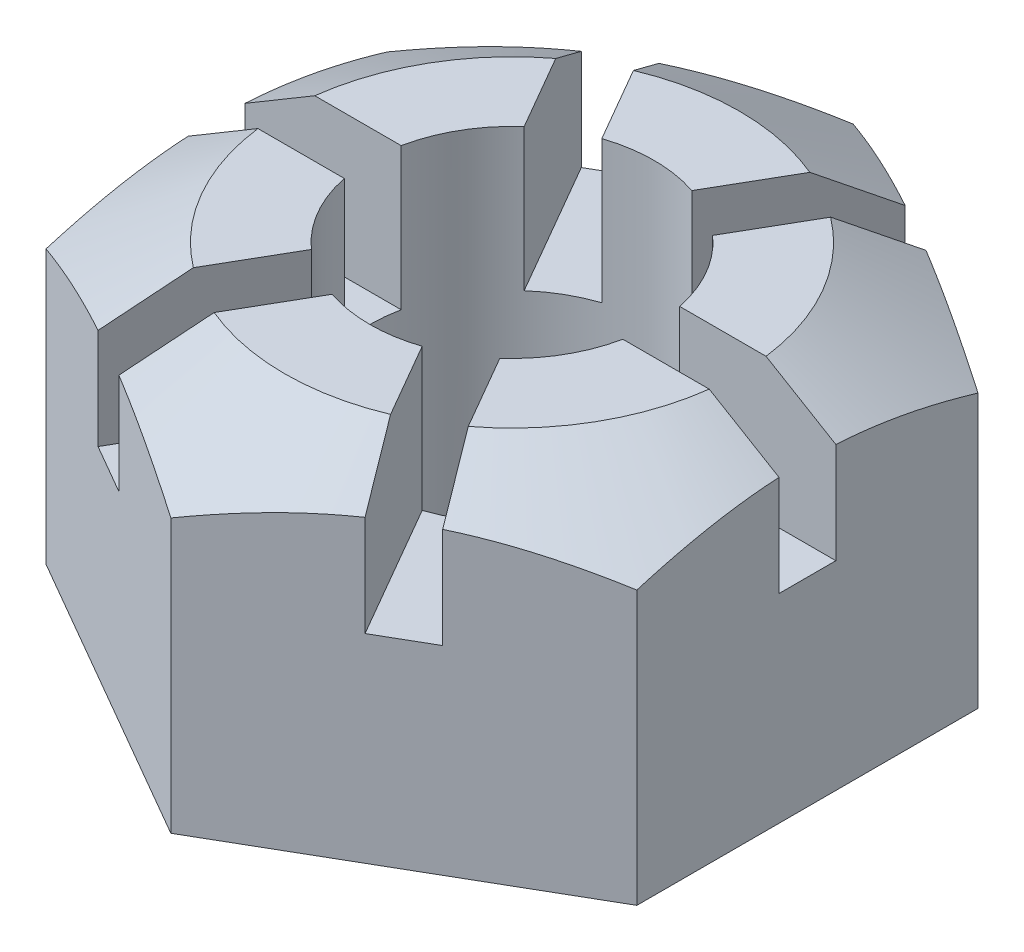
SolidWorks part; units mm, degrees
ref_plane "Front Plane" through (0, 0, 0) normal (0, 0, 1) x (1, 0, 0)
ref_plane "Top Plane" through (0, 0, 0) normal (0, 1, 0) x (1, 0, 0)
ref_plane "Right Plane" through (0, 0, 0) normal (1, 0, 0) x (0, 0, -1)
sketch "Sketch1" plane through (0, 0, 0) normal (0, 1, 0) x (1, 0, 0)
  line L1 (0, -60) -> (51.9615, -30)
  line L2 (51.9615, -30) -> (51.9615, 30)
  line L3 (51.9615, 30) -> (0, 60)
  line L4 (0, 60) -> (-51.9615, 30)
  line L5 (-51.9615, 30) -> (-51.9615, -30)
  line L6 (-51.9615, -30) -> (0, -60)
  circle A0 centre (0, 0) radius 51.9615 construction
  dimension "D1" = 120
extrude "Boss-Extrude1" add sketch "Sketch1" along normal mid plane 60
sketch "Sketch2" plane through (0, 30, 0) normal (0, 1, 0) x (1, 0, 0)
  circle A0 centre (0, 0) radius 25
  dimension "D1" = 50
extrude "Cut-Extrude1" cut sketch "Sketch2" against normal up to surface (60 mm away)
sketch "Sketch3" plane through (0, 0, 0) normal (1, 0, 0) x (0, 0, -1)
  line L0 (40, 30) -> (60, 18.0353)
  line L1 (60, 18.0353) -> (60, 30)
  line L2 (60, 30) -> (40, 30)
  line L3 (0, -30) -> (0, -10.4044) construction
  line L4 (-30, -30) -> (30, -30) construction
  line L5 (60, 30) -> (60, -30) construction
  circle A0 centre (60, 30) radius 20 construction
  point P10 (60, 18.0353)
  dimension "D1" = 40
revolve "Cut-Revolve1" cut sketch "Sketch3" angle 360 about L3
sketch "Sketch4" plane through (0, 30, 0) normal (0, 1, 0) x (1, 0, 0)
  line L0 (25.6699, 54.4615) -> (-34.3301, -49.4615)
  line L1 (25.6699, 54.4615) -> (34.3301, 49.4615)
  line L2 (-34.3301, -49.4615) -> (-25.6699, -54.4615)
  line L3 (34.3301, 49.4615) -> (-25.6699, -54.4615)
  line L4 (25.6699, 54.4615) -> (-25.6699, -54.4615) construction
  line L5 (-34.3301, -49.4615) -> (34.3301, 49.4615) construction
  line L6 (-51.9615, -30) -> (0, -60) construction
  line L7 (34.3301, -49.4615) -> (-25.6699, 54.4615)
  line L8 (34.3301, -49.4615) -> (25.6699, -54.4615)
  line L9 (25.6699, -54.4615) -> (-34.3301, 49.4615)
  line L10 (-25.6699, 54.4615) -> (-34.3301, 49.4615)
  line L11 (-60, -5) -> (60, -5)
  line L12 (-60, -5) -> (-60, 5)
  line L13 (-60, 5) -> (60, 5)
  line L14 (60, -5) -> (60, 5)
  point P1 (0, 0)
  point P9 (-50.9616, 53.0753)
  point P18 (0, 0)
  dimension "D1" = 10
  dimension "D2" = 120
  dimension "D3" = 3
extrude "Cut-Extrude2" cut sketch "Sketch4" against normal blind 25 contours L9 L10 L7 L8 | L11 L14 L13 L12 | L3 L2 L0 L1
